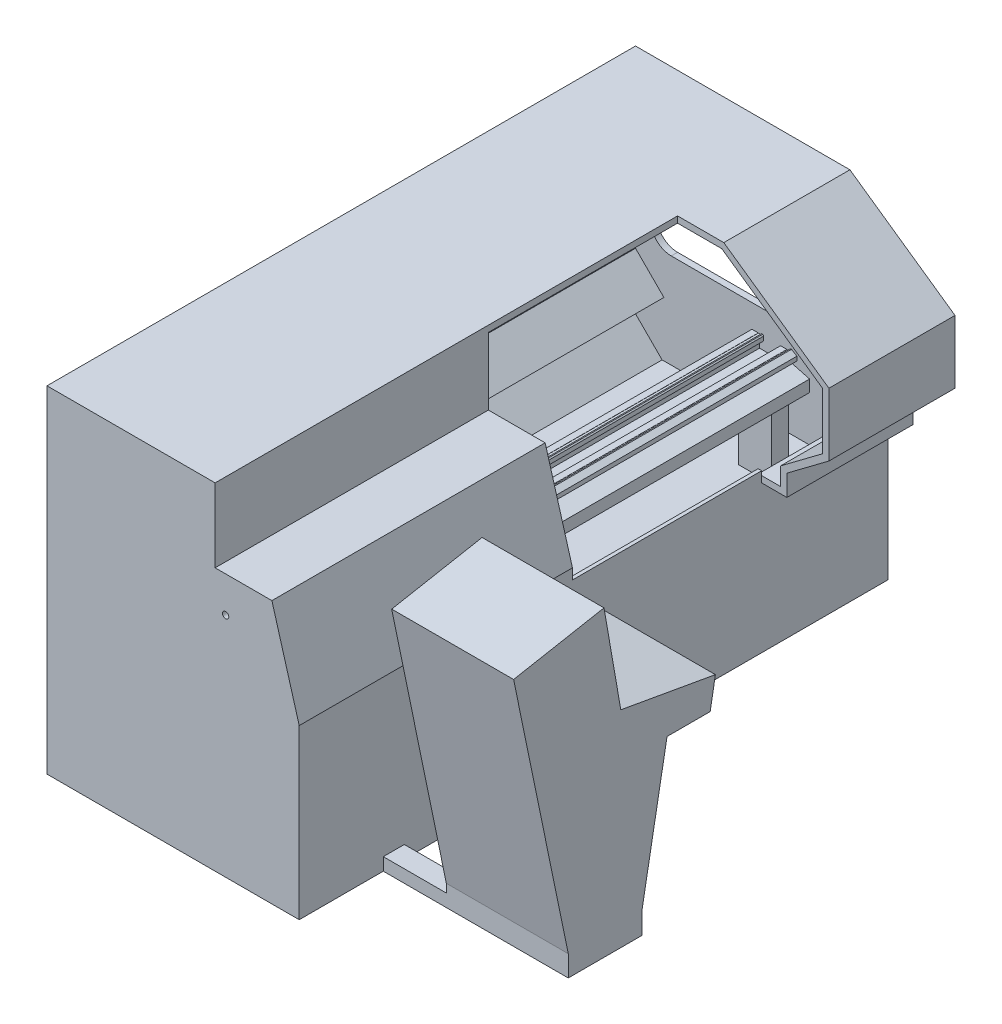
SolidWorks part; units mm, degrees
ref_plane "Face" through (0, 0, 0) normal (0, 0, 1) x (1, 0, 0)
ref_plane "Dessus" through (0, 0, 0) normal (0, 1, 0) x (1, 0, 0)
ref_plane "Droite" through (0, 0, 0) normal (1, 0, 0) x (0, 0, -1)
sketch "Esquisse1" plane through (0, 0, 0) normal (0, 0, 1) x (1, 0, 0)
  line L0 (1020, 1600) -> (1520, 1250)
  line L1 (1520, 1250) -> (1520, 950)
  line L2 (0, 0) -> (1200, 0)
  line L3 (0, 0) -> (0, 1600)
  line L4 (0, 1600) -> (1020, 1600)
  line L5 (1200, 0) -> (1200, 700)
  line L6 (1520, 950) -> (1320, 800)
  line L7 (1320, 800) -> (1320, 700)
  line L8 (1320, 700) -> (1200, 700)
  dimension "D1" = 1600
  dimension "D2" = 1200
  dimension "D3" = 500
  dimension "D4" = 350
  dimension "D5" = 1020
  dimension "D6" = 300
  dimension "D7" = 150
  dimension "D8" = 200
  dimension "D9" = 100
extrude "Extrusion1" add sketch "Esquisse1" against normal blind 2800
sketch "Esquisse2" plane through (0, 0, 0) normal (0, 0, 1) x (1, 0, 0)
  line L0 (1200, 700) -> (1200, 800)
  line L1 (1200, 800) -> (1070, 1250)
  line L2 (1070, 1250) -> (800, 1250)
  line L3 (800, 1250) -> (800, 1600)
  line L4 (1020, 1600) -> (0, 1600) construction
  line L5 (0, 1600) -> (0, 0) construction
  line L6 (0, 0) -> (1200, 0) construction
  line L7 (800, 1600) -> (900, 1736.8993)
  line L8 (900, 1736.8993) -> (1604.057, 1736.8993)
  line L9 (1604.057, 1736.8993) -> (1604.057, 700)
  line L10 (1604.057, 700) -> (1200, 700)
  dimension "D1" = 350
  dimension "D2" = 270
  dimension "D3" = 800
  dimension "D4" = 800
  dimension "D5" = 804.057
  dimension "D6" = 136.8993
  dimension "D7" = 100
extrude "Enlèv. mat.-Extru.1" cut sketch "Esquisse2" against normal blind 2200
ref_plane "Plan1" through (0, 0, -1300) normal (0, 0, 1) x (1, 0, 0)
sketch "Esquisse3" plane through (0, 0, -1300) normal (0, 0, 1) x (1, 0, 0)
  line L0 (30, 1570) -> (770, 1570)
  line L1 (770, 1570) -> (770, 1220)
  line L2 (770, 1220) -> (1047.4399, 1220)
  line L3 (1047.4399, 1220) -> (1185, 743.8304)
  line L4 (1185, 743.8304) -> (1185, 663.8304)
  line L5 (1185, 663.8304) -> (921.1696, 400)
  line L6 (30, 1570) -> (30, 796.5209)
  line L7 (800, 1600) -> (0, 1600) construction
  line L8 (921.1696, 400) -> (156.5209, 400)
  line L9 (156.5209, 400) -> (30, 526.5209)
  line L10 (1200, 0) -> (1200, 800) construction
  line L11 (1200, 0) -> (1200, 700) construction
  line L12 (1070, 1250) -> (1200, 800) construction
  line L13 (800, 1250) -> (1070, 1250) construction
  line L14 (800, 1600) -> (800, 1250) construction
  line L15 (0, 0) -> (1200, 0) construction
  line L16 (30, 526.5209) -> (165, 661.5209)
  line L17 (30, 796.5209) -> (165, 661.5209)
  line L18 (0, 1600) -> (0, 0) construction
  dimension "D1" = 30
  dimension "D2" = 30
  dimension "D3" = 45
  dimension "D4" = 15
  dimension "D5" = 30
  dimension "D6" = 30
  dimension "D7" = 30
  dimension "D8" = 80
  dimension "D9" = 400
  dimension "D10" = 135
  dimension "D11" = 135
  dimension "D12" = 30
  dimension "D13" = 90
  dimension "D14" = 135
extrude "Enlèv. mat.-Extru.2" cut sketch "Esquisse3" against normal blind 1470
sketch "Esquisse4" plane through (1200, 0, 0) normal (1, 0, 0) x (0, 0, -1)
  line L0 (2200, 800) -> (0, 800) construction
  line L1 (1300, 1570) -> (2200, 1570)
  line L2 (1300, 1570) -> (1300, 750)
  line L3 (1300, 750) -> (2200, 750)
  line L4 (2200, 1570) -> (2200, 750)
  line L5 (2200, 1600) -> (0, 1600) construction
  line L6 (1300, 838.207) -> (1300, -838.207) construction
  dimension "D1" = 50
  dimension "D2" = 30
  dimension "D3" = 900
extrude "Enlèv. mat.-Extru.3" cut sketch "Esquisse4" against normal blind 500
sketch "Esquisse5" plane through (0, 0, -2200) normal (0, 0, 1) x (1, 0, 0)
  line L0 (730.6079, 1570) -> (1010.5433, 1570)
  line L1 (1010.5433, 1570) -> (1490, 1234.3803)
  line L2 (1490, 1234.3803) -> (1490, 965)
  line L3 (1490, 965) -> (1290, 815)
  line L4 (1290, 815) -> (1290, 730)
  line L5 (1290, 730) -> (1132.7314, 730)
  line L6 (1132.7314, 730) -> (685.57, 1098.5943)
  line L7 (685.57, 1098.5943) -> (730.6079, 1570)
  line L8 (800, 1600) -> (1020, 1600) construction
  line L9 (1520, 1250) -> (1520, 950) construction
  line L10 (1320, 800) -> (1320, 700) construction
  line L11 (1200, 700) -> (1320, 700) construction
  line L13 (1020, 1600) -> (1520, 1250) construction
  line L14 (1520, 950) -> (1320, 800) construction
  point P20 (1420, 875)
  dimension "D1" = 30
  dimension "D2" = 30
  dimension "D3" = 30
  dimension "D4" = 30
  dimension "D5" = 30
  dimension "D6" = 30
extrude "Enlèv. mat.-Extru.4" cut sketch "Esquisse5" against normal blind 570
sketch "Esquisse6" plane through (0, 0, -2800) normal (0, 0, -1) x (-1, 0, 0)
  line L0 (-956.9556, 1500) -> (-200, 1500)
  line L1 (-100, 1400) -> (-100, 950)
  line L2 (-200, 850) -> (-1200, 850)
  line L3 (-1014.3018, 1481.9232) -> (-1257.3462, 1311.7921)
  line L4 (-1300, 1229.8689) -> (-1300, 950)
  line L5 (-1020, 1600) -> (0, 1600) construction
  line L6 (0, 1600) -> (0, 0) construction
  line L7 (-1520, 1250) -> (-1020, 1600) construction
  arc A0 (-1200, 850) -> (-1300, 950) centre (-1200, 950) cw
  arc A1 (-1300, 1229.8689) -> (-1257.3462, 1311.7921) centre (-1200, 1229.8689) cw
  arc A2 (-956.9556, 1500) -> (-1014.3018, 1481.9232) centre (-956.9556, 1400) ccw
  arc A3 (-100, 1400) -> (-200, 1500) centre (-200, 1400) ccw
  arc A4 (-200, 850) -> (-100, 950) centre (-200, 950) ccw
  point P13 (-1300, 850)
  point P20 (-100, 1500)
  point P23 (-100, 850)
  dimension "D6" = 100
  dimension "D1" = 100
  dimension "D2" = 650
  dimension "D3" = 100
  dimension "D4" = 1200
  dimension "D5" = 100
extrude "Enlèv. mat.-Extru.5" cut sketch "Esquisse6" against normal blind 570
sketch "Esquisse11" plane through (1200, 0, 0) normal (1, 0, 0) x (0, 0, -1)
  text T0 "EUROTURN VERT  N°1" font "Century Gothic" height 100
sketch "Esquisse16" plane through (-248.2604, 248.2604, 0) normal (0.7071, -0.7071, 0) x (0, 0, -1)
  line L0 (2770, 393.5197) -> (1300, 393.5197) construction
  line L1 (1380, 393.5197) -> (2740, 393.5197)
  line L2 (1380, 393.5197) -> (1380, 554.4385)
  line L3 (1380, 554.4385) -> (2740, 554.4385)
  line L4 (2740, 393.5197) -> (2740, 554.4385)
  line L5 (2800, 1131.3708) -> (2800, 0) construction
  line L6 (1300, 584.4385) -> (1300, 393.5197) construction
  line L7 (2770, 584.4385) -> (1300, 584.4385) construction
  dimension "D1" = 60
  dimension "D2" = 80
  dimension "D3" = 30
extrude "Enlèv. mat.-Extru.6" cut sketch "Esquisse16" against normal through all
sketch "Esquisse17" plane through (0, 0, -1300) normal (0, 0, -1) x (-1, 0, 0)
  line L0 (-1070, 1250) -> (-800, 1250) construction
  circle A0 centre (-850, 1080) radius 85
  dimension "D1" = 170
  dimension "D2" = 170
  dimension "D3" = 220
extrude "Extrusion8" add sketch "Esquisse17" along normal blind 34
sketch "Esquisse18" plane through (0, 0, -1334) normal (0, 0, -1) x (-1, 0, 0)
  circle A0 centre (-850, 1080) radius 70
  circle A1 centre (-850, 1080) radius 85 construction
  dimension "D1" = 140
extrude "Extrusion9" add sketch "Esquisse18" along normal blind 6
sketch "Esquisse20" plane through (0, 0, -1300) normal (0, 0, -1) x (-1, 0, 0)
  line L0 (-784, 910) -> (-754, 910)
  line L1 (-784, 910) -> (-784, 909)
  line L2 (-794, 909) -> (-784, 909)
  line L3 (-794, 909) -> (-800, 915)
  line L4 (-800, 915) -> (-805, 915)
  line L5 (-805, 915) -> (-810, 910)
  line L6 (-810, 910) -> (-810, 890)
  line L7 (-810, 890) -> (-790, 890)
  line L8 (-790, 890) -> (-790, 850)
  line L9 (-790, 850) -> (-910, 850)
  line L10 (-910, 850) -> (-910, 890)
  line L11 (-910, 890) -> (-890, 890)
  line L12 (-890, 890) -> (-890, 910)
  line L13 (-890, 910) -> (-920, 910)
  line L14 (-920, 910) -> (-920, 909)
  line L15 (-920, 909) -> (-930, 909)
  line L16 (-930, 909) -> (-937, 921.1244)
  line L17 (-937, 921.1244) -> (-942, 921.1244)
  line L18 (-942, 921.1244) -> (-968, 906.1132)
  line L19 (-968, 906.1132) -> (-968, 886.1132)
  line L20 (-968, 886.1132) -> (-938, 886.1132)
  line L21 (-938, 886.1132) -> (-938, 866.1132)
  line L22 (-938, 866.1132) -> (-1028, 841.9978)
  line L23 (-1028, 841.9978) -> (-1028, 786.1132)
  line L24 (-1028, 786.1132) -> (-928, 786.1132)
  line L25 (-928, 786.1132) -> (-928, 736.1244)
  line L26 (-928, 736.1244) -> (-828, 736.1244)
  line L27 (-754, 910) -> (-754, 786.1132)
  line L28 (-754, 786.1132) -> (-828, 786.1132)
  line L29 (-828, 736.1244) -> (-828, 786.1132)
  circle A0 centre (-850, 1080) radius 85 construction
  circle A1 centre (-850, 1080) radius 85 construction
  dimension "D1" = 170
  dimension "D8" = 40
  dimension "D2" = 30
  dimension "D4" = 10
  dimension "D5" = 135
  dimension "D6" = 5
  dimension "D7" = 5
  dimension "D9" = 20
  dimension "D10" = 20
  dimension "D11" = 40
  dimension "D12" = 120
  dimension "D13" = 40
  dimension "D14" = 20
  dimension "D15" = 20
  dimension "D16" = 30
  dimension "D17" = 1
  dimension "D18" = 10
  dimension "D19" = 120
  dimension "D20" = 7
  dimension "D21" = 5
  dimension "D22" = 26
  dimension "D23" = 30
  dimension "D24" = 20
  dimension "D25" = 30
  dimension "D26" = 20
  dimension "D27" = 80
  dimension "D28" = 90
  dimension "D29" = 105
  dimension "D30" = 100
  dimension "D31" = 185
  dimension "D32" = 100
  dimension "D34" = 1
extrude "Extrusion10" add sketch "Esquisse20" along normal blind 1300
sketch "Esquisse25" plane through (0, 0, -1300) normal (0, 0, -1) x (-1, 0, 0)
  line L0 (-1146.2657, 620) -> (-928, 620)
  line L1 (-890, 910) -> (-920, 910) construction
  line L2 (-1146.2657, 620) -> (-921.1696, 400)
  line L3 (-921.1696, 400) -> (-156.5209, 400)
  line L4 (-156.5209, 400) -> (-921.1696, 400) construction
  line L5 (-156.5209, 400) -> (-30, 526.5209)
  line L6 (-30, 526.5209) -> (-156.5209, 400) construction
  line L7 (-30, 526.5209) -> (-30, 620)
  line L8 (-928, 736.1244) -> (-928, 620)
  line L9 (-828, 736.1244) -> (-828, 620)
  line L10 (-828, 620) -> (-30, 620)
  line L11 (-928, 736.1244) -> (-828, 736.1244)
  point P2 (-905, 910)
  dimension "D1" = 290
extrude "Extrusion11" add sketch "Esquisse25" along normal blind 80
sketch "Esquisse26" plane through (0, 0, -2600) normal (0, 0, -1) x (-1, 0, 0)
  line L1 (-928, 736.1244) -> (-770.8771, 736.1244)
  line L2 (-928, 736.1244) -> (-928, 386.1244)
  line L3 (-928, 386.1244) -> (-770.8771, 386.1244)
  line L4 (-770.8771, 736.1244) -> (-770.8771, 386.1244)
  dimension "D1" = 350
extrude "Extrusion12" add sketch "Esquisse26" against normal blind 80
sketch "Esquisse27" plane through (0, 0, -1340) normal (0, 0, -1) x (-1, 0, 0)
  circle A0 centre (-850, 1080) radius 67
  circle A1 centre (-850, 1080) radius 70 construction
  dimension "D1" = 134
extrude "Extrusion13" add sketch "Esquisse27" along normal blind 10
sketch "Esquisse29" plane through (0, 0, -1350) normal (0, 0, -1) x (-1, 0, 0)
  circle A0 centre (-850, 1080) radius 14.85
  circle A1 centre (-850, 1080) radius 67 construction
  dimension "D1" = 29.7
extrude "Enlèv. mat.-Extru.7" cut sketch "Esquisse29" against normal blind 4000
sketch "Esquisse30" plane through (1200, 0, 0) normal (1, 0, 0) x (0, 0, -1)
  line L0 (2800, 0) -> (0, 0) construction
  line L1 (400, 60) -> (500, 60)
  line L2 (400, 60) -> (400, 0)
  line L3 (400, 0) -> (500, 0)
  line L4 (500, 60) -> (500, 0)
  dimension "D1" = 60
  dimension "D2" = 100
  dimension "D3" = 400
extrude "Extrusion14" add sketch "Esquisse30" along normal blind 300
sketch "Esquisse31" plane through (1500, 0, 0) normal (1, 0, 0) x (0, 0, -1)
  line L0 (400, 0) -> (750, 0)
  line L1 (400, 0) -> (400, 100)
  line L2 (140, 1360) -> (570, 1440)
  line L3 (570, 1440) -> (650, 980)
  line L4 (650, 980) -> (1100, 900)
  line L5 (1100, 900) -> (1075.1111, 760)
  line L6 (1075.1111, 760) -> (870, 760)
  line L7 (750, 0) -> (750, 100)
  line L8 (140, 1360) -> (400, 100)
  line L9 (870, 760) -> (750, 100)
  dimension "D1" = 350
  dimension "D2" = 1360
  dimension "D3" = 260
  dimension "D4" = 170
  dimension "D5" = 980
  dimension "D6" = 900
  dimension "D7" = 760
  dimension "D8" = 470
  dimension "D9" = 700
  dimension "D10" = 250
  dimension "D11" = 1440
  dimension "D12" = 100
  dimension "D13" = 100
extrude "Extrusion15" add sketch "Esquisse31" along normal blind 580
sketch "Esquisse32" plane through (0, 138.4954, -796.3486) normal (0, 0.1713, -0.9852) x (-1, 0, 0)
  text T0 "NUM 1060" font "Century Schoolbook" height 60
